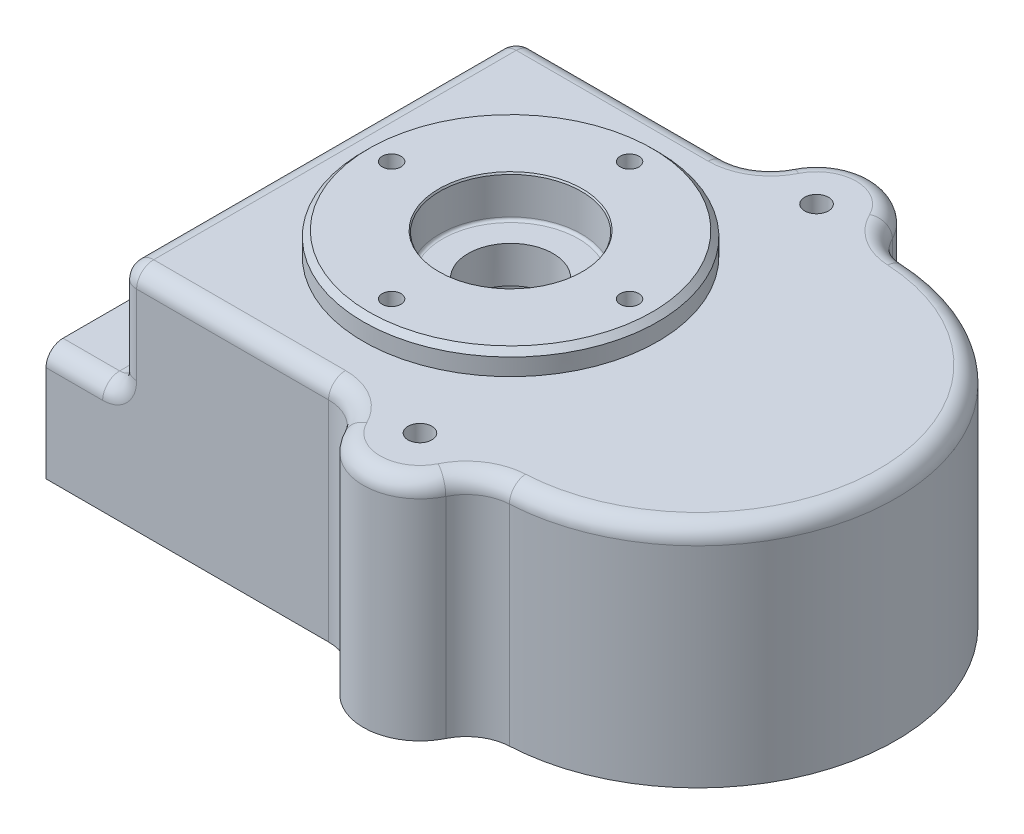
SolidWorks part; units mm, degrees
ref_plane "정면" through (0, 0, 0) normal (0, 0, 1) x (1, 0, 0)
ref_plane "윗면" through (0, 0, 0) normal (0, 1, 0) x (1, 0, 0)
ref_plane "우측면" through (0, 0, 0) normal (1, 0, 0) x (0, 0, -1)
sketch "스케치1" plane through (0, 0, 0) normal (0, 1, 0) x (1, 0, 0)
  line L5 (0, -35) -> (67, -35)
  line L6 (0, -35) -> (0, 35)
  line L7 (0, 35) -> (67, 35)
  arc A0 (67, 35) -> (67, -35) centre (67, 0) cw
  point P5 (0, 0)
  point P7 (66.9982, 34.5136)
  point P9 (0, 0)
  dimension "D1" = 35
  dimension "D2" = 102
extrude "보스-돌출1" add sketch "스케치1" along normal blind 40
sketch "스케치2" plane through (0, 0, 0) normal (1, 0, 0) x (0, 0, -1)
  line L1 (-35, 0) -> (-15, 0)
  line L2 (-35, 0) -> (-35, 20)
  line L3 (-35, 20) -> (-15, 20)
  line L4 (-15, 0) -> (-15, 20)
  dimension "D1" = 20
  dimension "D2" = 20
extrude "보스-돌출2" add sketch "스케치2" against normal blind 13
sketch "스케치3" plane through (0, 0, 0) normal (0, 1, 0) x (1, 0, 0)
  line L0 (0, -35) -> (67, -35) construction
  circle A0 centre (53, -35) radius 10
  point P4 (0, 0)
  point P5 (0, 0)
  dimension "D1" = 20
  dimension "D2" = 53
extrude "보스-돌출3" add sketch "스케치3" along normal up to surface (40 mm away)
hole_wizard "M5 나사 구멍1" positions "스케치4" profile "스케치5" tap size "M5" standard "KS"
sketch "스케치4" plane through (-13, 0, 0) normal (-1, 0, 0) x (0, 0, 1)
  line L0 (0, 0) -> (0, 40) construction
  line L2 (35, 0) -> (15, 0) construction
  line L3 (-35, 40) -> (35, 40) construction
  point P0 (25, 10)
  point P13 (25, 10.2159)
  point P16 (0, 38.611)
  point P19 (0, 0)
  dimension "D1" = 50
  dimension "D2" = 10
sketch "스케치5" plane through (-13, 10, 25) normal (0, 1, 0) x (0, 0, 1)
  line L0 (0, 0) -> (0, 17.2618)
  line L1 (0, 17.2618) -> (2.1, 16)
  line L2 (2.1, 16) -> (2.1, 0)
  line L5 (2.1, 0) -> (0, 0)
  line L10 (0, 17.2618) -> (-2.1, 16) construction
  line L11 (0, -6.35) -> (0, 107.95) construction
  dimension "탭 드릴 지름" = 4.2
  dimension "탭 드릴 깊이" = 16
  dimension "드릴 각도" = 118
mirror "대칭 복사1" about plane through (0, 0, 0) normal (0, 0, 1) of "M5 나사 구멍1", "보스-돌출2", "보스-돌출3"
fillet "필렛2" radius 3 2 edges at (-6.5, 20, 15) (-6.5, 20, -15)
fillet "필렛4" radius 8 4 edges at (63, 20, 35) (43, 20, 35) (43, 20, -35) (63, 20, -35)
fillet "필렛3" radius 3 20 edges at (-6.5, 20, -35) (-6.5, 20, 35) (102, 40, 0) (18.4377, 40, 35) (53.0167, 40, 45) (18.4377, 40, -35) (53.0167, 40, -45) (0, 19.1213, -15.8787) (0, 20, -26.5) (0, 30, -35) (0, 40, 0) (0, 30, 35) (0, 20, 26.5) (0, 19.1213, 15.8787) (0, 8.5, 15) (0, 8.5, -15) (64.7548, 40, 36.2624) (41.0919, 40, 36.2013) (41.0919, 40, -36.2013) (64.7548, 40, -36.2624)
sketch "스케치6" plane through (0, 40, 0) normal (0, 1, 0) x (1, 0, 0)
  circle A0 centre (34, 0) radius 26
  point P2 (0, 0)
  dimension "D1" = 52
  dimension "D2" = 34
extrude "보스-돌출4" add sketch "스케치6" along normal blind 4
sketch "스케치7" plane through (0, 44, 0) normal (0, 1, 0) x (1, 0, 0)
  circle A0 centre (34, 0) radius 7.5
  dimension "D1" = 15
extrude "컷-돌출1" cut sketch "스케치7" against normal through all
sketch "스케치8" plane through (0, 44, 0) normal (0, 1, 0) x (1, 0, 0)
  circle A0 centre (34, 0) radius 12.5
  dimension "D1" = 25
extrude "컷-돌출2" cut sketch "스케치8" against normal blind 7.3
sketch "스케치9" plane through (0, 0, 0) normal (0, -1, 0) x (1, 0, 0)
  line L0 (34, 0) -> (0, 0) construction
  line L1 (43.9499, 15) -> (57.0501, 15)
  line L2 (43.9499, -15) -> (57.0501, -15)
  arc A0 (43.9499, 15) -> (43.9499, -15) centre (34, 0) ccw
  arc A1 (57.0501, -15) -> (57.0501, 15) centre (67, 0) ccw
  dimension "D1" = 36
  dimension "D2" = 33
  dimension "D3" = 30
extrude "컷-돌출3" cut sketch "스케치9" against normal blind 20
hole_wizard "Ø19.0 (19) 지름 구멍1" positions "스케치10" profile "스케치11" hole size "Ø19.0" standard "KS"
sketch "스케치10" plane through (0, 20, 0) normal (0, -1, 0) x (-1, 0, 0)
  point P0 (-67, 0)
  point P3 (-34, 0)
sketch "스케치11" plane through (67, 20, 0) normal (1, 0, 0) x (0, 0, -1)
  line L0 (0, 0) -> (0, 14.7082)
  line L1 (0, 14.7082) -> (9.5, 9)
  line L2 (9.5, 9) -> (9.5, 0)
  line L5 (9.5, 0) -> (0, 0)
  line L10 (0, 14.7082) -> (-9.5, 9) construction
  line L11 (0, -6.35) -> (0, 107.95) construction
  dimension "구멍 지름" = 19
  dimension "구멍 깊이" = 9
  dimension "드릴 각도" = 118
chamfer "모따기1" distance 1 angle 45 3 edges at (34, 20, -9.5) (67, 20, -9.5) (34, 44, 26)
chamfer "모따기2" distance 0.3 angle 30 1 edges at (34, 44, 12.5)
fillet "필렛5" radius 0.5 1 edges at (34, 36.7, 12.5)
hole_wizard "M4 나사 구멍1" positions "스케치12" profile "스케치13" tap size "M4" standard "KS"
sketch "스케치12" plane through (0, 44, 0) normal (0, 1, 0) x (1, 0, 0)
  circle A0 centre (34, 0) radius 21 construction
  point P0 (13, 0)
  dimension "D1" = 42
sketch "스케치13" plane through (13, 44, 0) normal (1, 0, 0) x (0, 0, 1)
  line L0 (0, 0) -> (0, 11.3914)
  line L1 (0, 11.3914) -> (1.65, 10.4)
  line L2 (1.65, 10.4) -> (1.65, 0)
  line L5 (1.65, 0) -> (0, 0)
  line L10 (0, 11.3914) -> (-1.65, 10.4) construction
  line L11 (0, -6.35) -> (0, 107.95) construction
  dimension "탭 드릴 지름" = 3.3
  dimension "탭 드릴 깊이" = 10.4
  dimension "드릴 각도" = 118
pattern_circular "원형 패턴1" count 4 over 360 about axis through (34, 0, 0) along (0, 1, 0) of "M4 나사 구멍1"
hole_wizard "M5 나사 구멍2" positions "스케치16" profile "스케치17" tap size "M5" standard "KS"
sketch "스케치16" plane through (0, 40, 0) normal (0, 1, 0) x (1, 0, 0)
  point P0 (53, -35)
sketch "스케치17" plane through (53, 40, 35) normal (1, 0, 0) x (0, 0, 1)
  line L0 (0, 0) -> (0, 40)
  line L1 (0, 40) -> (2.1, 40)
  line L2 (2.1, 40) -> (2.1, 0)
  line L5 (2.1, 0) -> (0, 0)
  line L11 (0, -6.35) -> (0, 107.95) construction
  dimension "관통 탭 드릴 지름" = 4.2
  dimension "관통 탭 드릴 깊이" = 40
mirror "대칭 복사2" about plane through (0, 0, 0) normal (0, 0, 1) of "M5 나사 구멍2"
